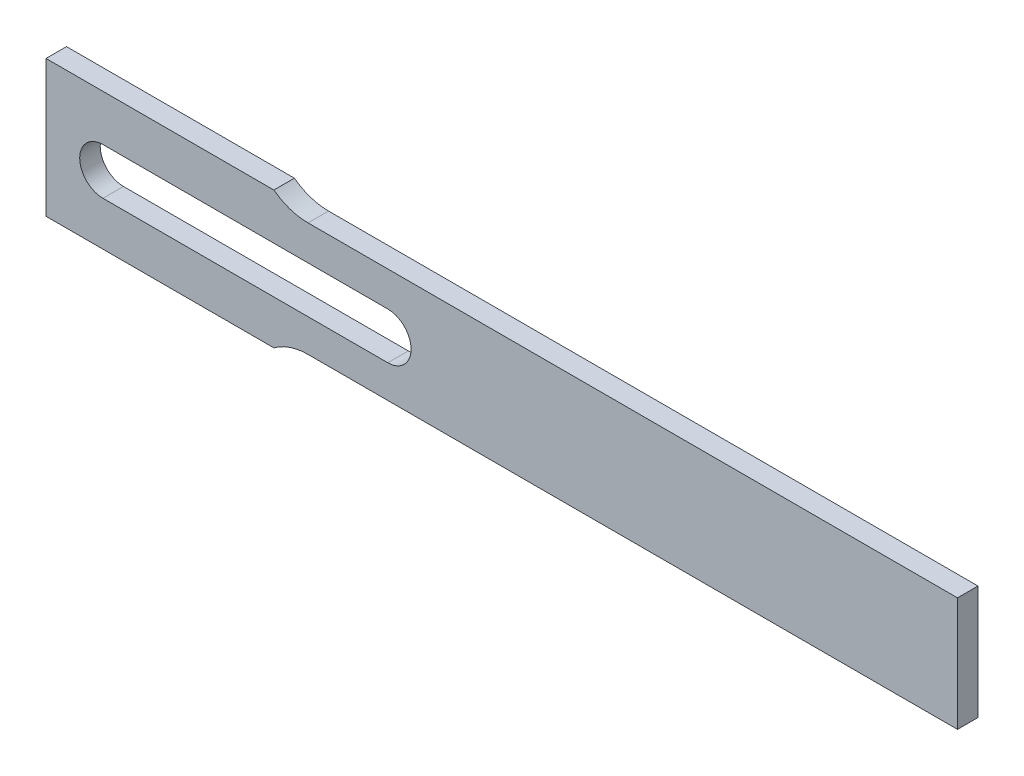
SolidWorks part; units mm, degrees
ref_plane "Front Plane" through (0, 0, 0) normal (0, 0, 1) x (1, 0, 0)
ref_plane "Top Plane" through (0, 0, 0) normal (0, 1, 0) x (1, 0, 0)
ref_plane "Right Plane" through (0, 0, 0) normal (1, 0, 0) x (0, 0, -1)
sketch "Sketch1" plane through (0, 0, 0) normal (0, 0, 1) x (1, 0, 0)
  line L0 (0, 0) -> (211.3366, 0) construction
  line L1 (0, 0) -> (0, 78.9562) construction
  line L2 (80, 5) -> (23, 5)
  line L3 (0, -6) -> (20, -6)
  line L4 (0, -6) -> (0, 6)
  line L5 (0, 6) -> (20, 6)
  line L6 (80, -5) -> (80, 5)
  line L7 (80, -5) -> (23, -5)
  arc A0 (20, 6) -> (23, 5) centre (23, 10) ccw
  arc A1 (23, -5) -> (20, -6) centre (23, -10) ccw
  dimension "D7" = 5
  dimension "D8" = 5
  dimension "D1" = 80
  dimension "D2" = 12
  dimension "D3" = 6
  dimension "D4" = 10
  dimension "D5" = 5
  dimension "D6" = 20
extrude "Extrude1" add sketch "Sketch1" along normal blind 1.8
sketch "Sketch2" plane through (0, 0, 0) normal (0, 0, 1) x (1, 0, 0)
  line L0 (0, 0) -> (83.6373, 0) construction
  line L1 (0, 6) -> (0, -6) construction
  line L2 (5, -2.1308) -> (30, -2.1308)
  line L4 (5, 1.9532) -> (30, 1.9532)
  arc A0 (5, 1.9532) -> (5, -2.1308) centre (5, -0.0888) ccw
  arc A1 (30, -2.1308) -> (30, 1.9532) centre (30, -0.0888) ccw
  dimension "D1" = 25
  dimension "D2" = 5
extrude "Extrude2" cut sketch "Sketch2" along normal through all
